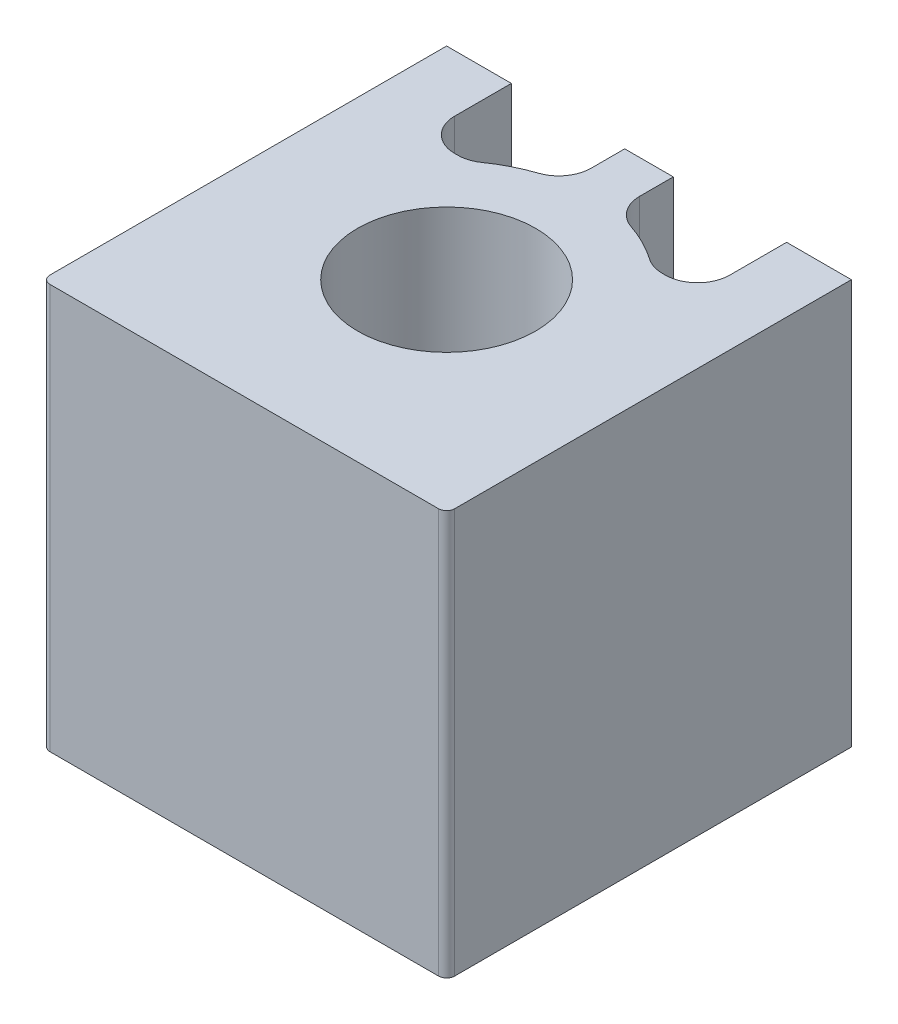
SolidWorks part; units mm, degrees
ref_plane "Plan de face" through (0, 0, 0) normal (0, 0, 1) x (1, 0, 0)
ref_plane "Plan de dessus" through (0, 0, 0) normal (0, 1, 0) x (1, 0, 0)
ref_plane "Plan de droite" through (0, 0, 0) normal (1, 0, 0) x (0, 0, -1)
sketch "Esquisse1" plane through (0, 0, 0) normal (0, 1, 0) x (1, 0, 0)
  line L0 (0, -20.2628) -> (0, 58.4186) construction
  line L1 (-24.3225, 0) -> (29.7425, 0) construction
  line L2 (25, -20.2628) -> (25, 58.4186) construction
  line L3 (-24.3225, 50) -> (34.6841, 50) construction
  line L4 (4, 55.6667) -> (4, -3.7395) construction
  line L6 (-17.7609, 25) -> (29.7425, 25) construction
  line L7 (12.5, 55.6667) -> (12.5, -13.5587) construction
  line L8 (0.5, 0) -> (24.5, 0)
  line L9 (21, 55.6667) -> (21, -3.7395) construction
  line L10 (-3.5126, 1) -> (27.2256, 1) construction
  line L13 (0, 25) -> (25, 25)
  line L15 (25, 25) -> (25, 0.5)
  line L16 (0, 25) -> (0, 0.5)
  arc A2 (24.5, 0) -> (25, 0.5) centre (24.5, 0.5) ccw
  arc A3 (0, 0.5) -> (0.5, 0) centre (0.5, 0.5) ccw
  dimension "D1" = 25
  dimension "D2" = 50
  dimension "D3" = 25
  dimension "D4" = 12.5
  dimension "D5" = 4
extrude "Extrusion1" add sketch "Esquisse1" along normal blind 25
sketch "Esquisse2" plane through (0, 0, 0) normal (0, -1, 0) x (1, 0, 0)
  line L0 (0, 9.4676) -> (0, -60.8727) construction
  line L1 (-5.7031, 0) -> (29.0572, 0) construction
  line L2 (29.0572, -25) -> (-5.7031, -25) construction
  line L3 (12.5, 9.4676) -> (12.5, -60.8727) construction
  line L4 (4, 9.4676) -> (4, -52.8814) construction
  line L5 (9.6643, -12.5) -> (19.7875, -12.5) construction
  line L6 (-5.7031, -5) -> (39.022, -5) construction
  line L7 (-5.7031, -16) -> (39.022, -16) construction
  line L8 (-5.7031, -19.5) -> (39.022, -19.5) construction
  line L9 (11, -52.8814) -> (11, 9.4676) construction
  line L10 (-5.7031, -45) -> (39.022, -45) construction
  line L11 (-5.7031, -34) -> (39.022, -34) construction
  line L12 (-5.7031, -30.5) -> (39.022, -30.5) construction
  line L17 (4, -30.5) -> (11, -30.5)
  line L18 (4, -30.5) -> (4, -19.5)
  line L19 (4, -19.5) -> (6.8431, -19.5)
  line L20 (11, -21.3741) -> (11, -30.5)
  line L21 (21, -19.5) -> (18.1569, -19.5)
  line L22 (14, -21.3741) -> (14, -30.5)
  line L23 (21, -30.5) -> (14, -30.5)
  line L24 (21, -30.5) -> (21, -19.5)
  circle A0 centre (12.5, -12.5) radius 5.5
  arc A1 (14, -21.3741) -> (18.1569, -19.5) centre (12.5, -12.5) ccw
  arc A3 (6.8431, -19.5) -> (11, -21.3741) centre (12.5, -12.5) ccw
  dimension "D1" = 25
  dimension "D2" = 12.5
  dimension "D3" = 1.5
  dimension "D4" = 5
  dimension "D5" = 11
  dimension "D6" = 3.5
  dimension "D7" = 4
  dimension "D8" = 12.5
extrude "Enlèv. mat.-Extru.1" cut sketch "Esquisse2" against normal blind 25
fillet "Congé2" radius 2 6 edges at (11, 12.5, -21.3741) (21, 12.5, -19.5) (18.1569, 12.5, -19.5) (14, 12.5, -21.3741) (6.8431, 12.5, -19.5) (4, 12.5, -19.5)
